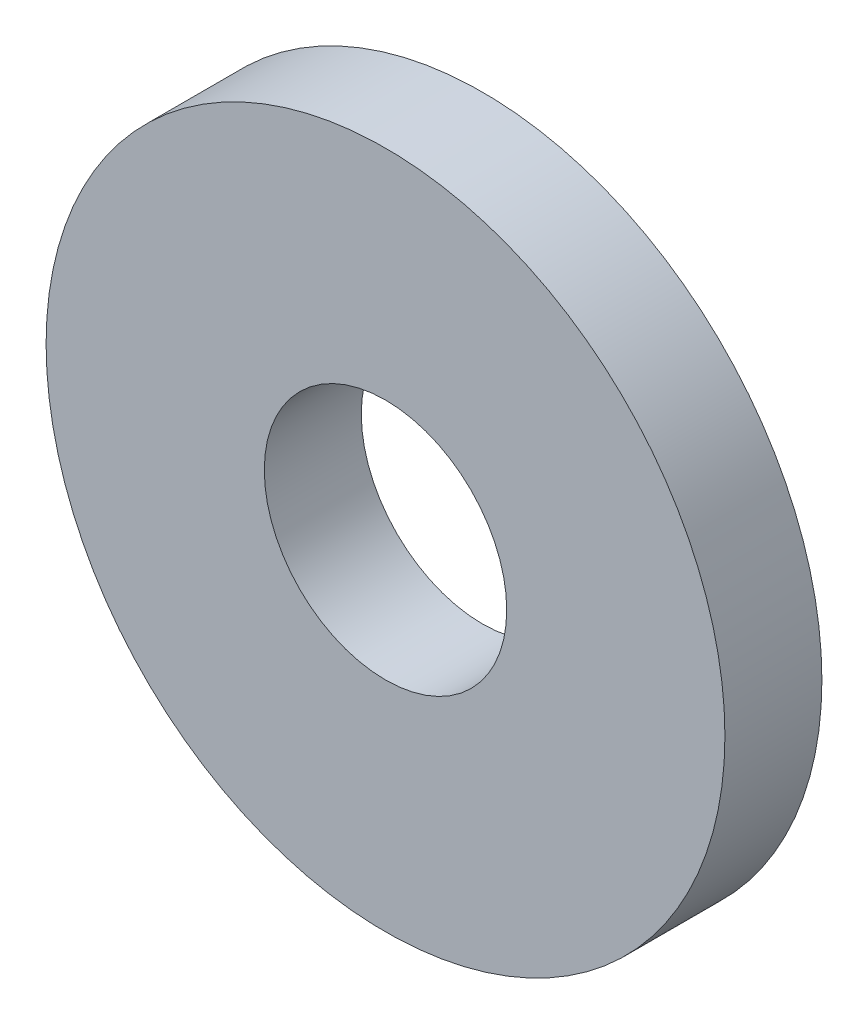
SolidWorks part; units mm, degrees
ref_plane "Front Plane" through (0, 0, 0) normal (0, 0, 1) x (1, 0, 0)
ref_plane "Top Plane" through (0, 0, 0) normal (0, 1, 0) x (1, 0, 0)
ref_plane "Right Plane" through (0, 0, 0) normal (1, 0, 0) x (0, 0, -1)
sketch "Sketch1" plane through (0, 0, 0) normal (0, 0, 1) x (1, 0, 0)
  circle A0 centre (0, 0) radius 14
  circle A1 centre (0, 0) radius 5
  dimension "D1" = 28
  dimension "D2" = 10
extrude "Boss-Extrude1" add sketch "Sketch1" along normal blind 4
